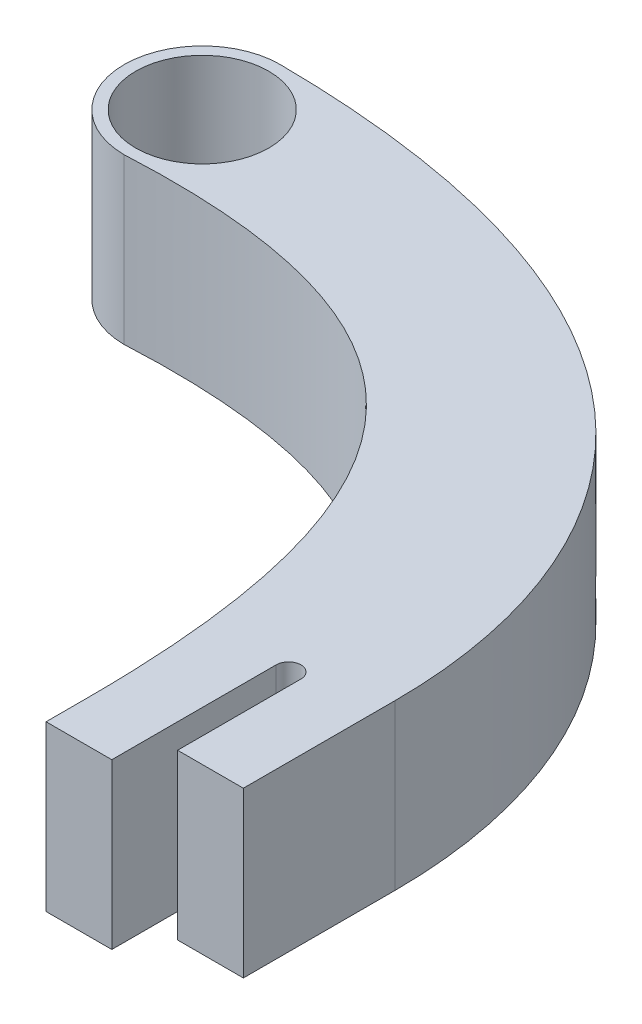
SolidWorks part; units mm, degrees
ref_plane "Спереди (плоскость XY)" through (0, 0, 0) normal (0, 0, 1) x (1, 0, 0)
ref_plane "Сверху(плоскость XZ)" through (0, 0, 0) normal (0, 1, 0) x (1, 0, 0)
ref_plane "Справа(плоскость ZY)" through (0, 0, 0) normal (1, 0, 0) x (0, 0, -1)
sketch "Эскиз1" plane through (0, 0, 0) normal (0, 1, 0) x (1, 0, 0)
  line L0 (0, 39.4743) -> (0, -106.9376) construction
  line L5 (55, -69) -> (55, -74)
  line L6 (55, -74) -> (63, -74)
  line L7 (63, -74) -> (63, -54)
  line L9 (66.0037, -54) -> (66.0037, -68.9993)
  line L10 (66.0037, -68.9993) -> (74.0037, -68.9993)
  line L11 (74.0037, -68.9993) -> (74.0037, -50.5402)
  circle A0 centre (0, 0) radius 8.1
  arc A1 (0, 9.5) -> (0, -9.5) centre (0, 0) ccw
  arc A2 (63, -54) -> (66.0037, -54) centre (64.5019, -54) cw
  spline S1 degree 3 poles (0, -9.5) (39.0098, -7.4881) (55, -25.5274) (55, -69) knots 0 0 0 0 1 1 1 1
  spline S2 degree 3 poles (74.0037, -50.5402) (74.0037, -23.6175) (57.2795, 9.0764) (0, 9.5) knots 0 0 0 0 1 1 1 1
  dimension "D1" = 19
  dimension "D4" = 16.2
  dimension "D10" = 5
  dimension "D11" = 20
  dimension "D5" = 8
  dimension "D6" = 74
  dimension "D7" = 3.0037
  dimension "D8" = 8
  dimension "D9" = 14.9993
extrude "Бобышка-Вытянуть1" add sketch "Эскиз1" along normal blind 20
sketch "Эскиз3" plane through (0, 0, 0) normal (0, -1, 0) x (1, 0, 0)
  circle A0 centre (0, 0) radius 8.1 construction
  circle A1 centre (0, 0) radius 8.1
extrude "Бобышка-Вытянуть2" add sketch "Эскиз3" against normal blind 2
